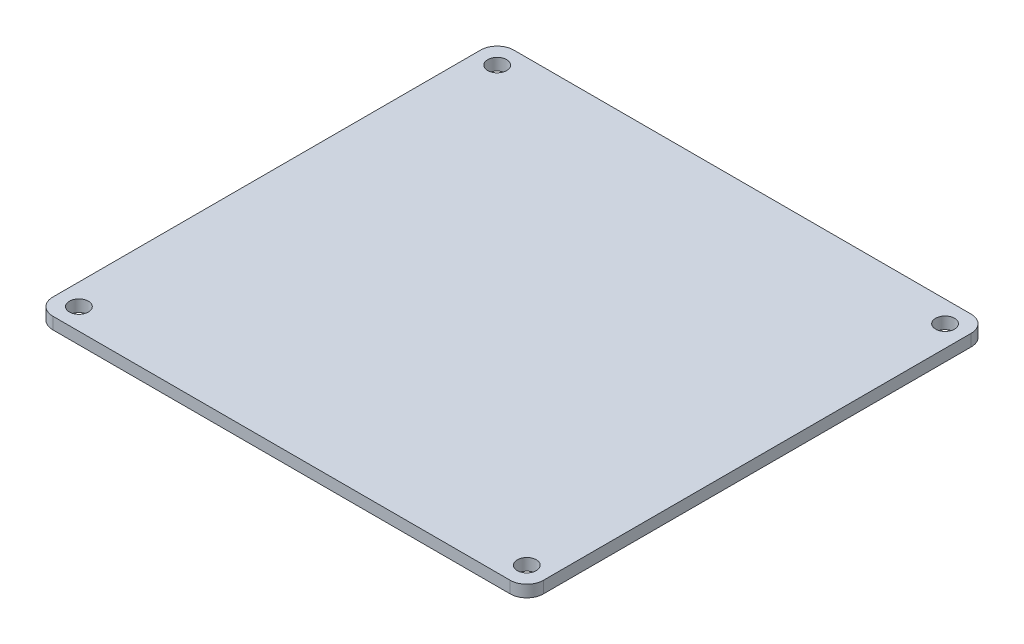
SolidWorks part; units mm, degrees
ref_plane "Plan de face" through (0, 0, 0) normal (0, 0, 1) x (1, 0, 0)
ref_plane "Plan de dessus" through (0, 0, 0) normal (0, 1, 0) x (1, 0, 0)
ref_plane "Plan de droite" through (0, 0, 0) normal (1, 0, 0) x (0, 0, -1)
sketch "Esquisse1" plane through (0, 0, 0) normal (0, 1, 0) x (1, 0, 0)
  line L0 (-10.1907, 0) -> (136.9816, 0) construction
  line L1 (82.8, -9.8352) -> (82.8, 99.1813) construction
  line L2 (139.3515, 77.8) -> (-14.6935, 77.8) construction
  line L3 (0, -9.8352) -> (0, 99.1813) construction
  line L4 (41.4, 54.6982) -> (41.4, 16.4175) construction
  line L5 (2.8, 77.8) -> (80, 77.8)
  line L6 (0, 75) -> (0, 2.8)
  line L7 (2.8, 0) -> (80, 0)
  line L8 (82.8, 75) -> (82.8, 2.8)
  line L9 (21.4648, 38.9) -> (62.17, 38.9) construction
  line L10 (-1.8907, 3.6) -> (10.5242, 3.6) construction
  line L11 (3.6, 9.2304) -> (3.6, -3.1343) construction
  arc A0 (2.8, 77.8) -> (0, 75) centre (2.8, 75) ccw
  arc A1 (80, 77.8) -> (82.8, 75) centre (80, 75) cw
  arc A2 (80, 0) -> (82.8, 2.8) centre (80, 2.8) ccw
  arc A3 (0, 2.8) -> (2.8, 0) centre (2.8, 2.8) ccw
  circle A4 centre (3.6, 3.6) radius 1.6
  circle A5 centre (79.2, 3.6) radius 1.6
  circle A6 centre (79.2, 74.2) radius 1.6
  circle A7 centre (3.6, 74.2) radius 1.6
  dimension "D1" = 2.8
  dimension "D2" = 3.6
  dimension "D3" = 3.6
extrude "Extrusion1" add sketch "Esquisse1" along normal blind 2
